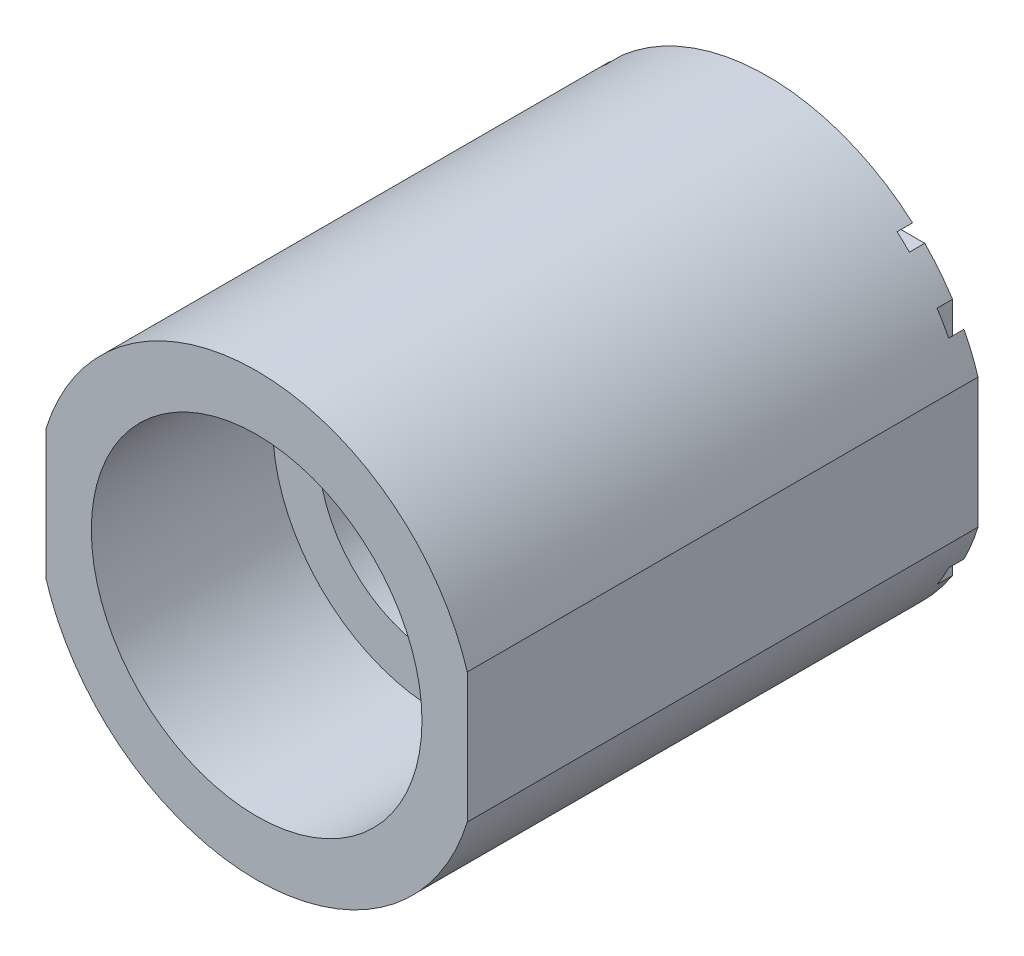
SolidWorks part; units mm, degrees
ref_plane "Front Plane" through (0, 0, 0) normal (0, 0, 1) x (1, 0, 0)
ref_plane "Top Plane" through (0, 0, 0) normal (0, 1, 0) x (1, 0, 0)
ref_plane "Right Plane" through (0, 0, 0) normal (1, 0, 0) x (0, 0, -1)
sketch "Sketch1" plane through (0, 0, 0) normal (0, 0, 1) x (1, 0, 0)
  circle A0 centre (0, 0) radius 28.575
  dimension "D1" = 57.15
extrude "Boss-Extrude1" add sketch "Sketch1" along normal blind 67
sketch "Sketch2" plane through (0, 0, 67) normal (0, 0, 1) x (1, 0, 0)
  circle A0 centre (0, 0) radius 15.4781
  dimension "D1" = 30.9562
extrude "Cut-Extrude1" cut sketch "Sketch2" against normal blind 57
sketch "Sketch3" plane through (0, 0, 67) normal (0, 0, 1) x (1, 0, 0)
  circle A0 centre (0, 0) radius 21.4312
  dimension "D1" = 42.8625
extrude "Cut-Extrude2" cut sketch "Sketch3" against normal blind 23.5
sketch "Sketch7" plane through (0, 0, 0) normal (0, 0, -1) x (-1, 0, 0)
  circle A0 centre (0, 0) radius 7.5
  dimension "D1" = 15
extrude "Cut-Extrude4" cut sketch "Sketch7" against normal up to next
sketch "Sketch4" plane through (0, 0, 0) normal (0, 1, 0) x (1, 0, 0)
  line L0 (0, -64) -> (0, -31.0654) construction
  line L1 (-16, -9.4837) -> (0, -9.4837) construction
  line L2 (-16, -65) -> (-16, 49935) construction
  line L3 (-21.4312, -67) -> (21.4312, -67) construction
  line L4 (-21.4312, -43.5) -> (21.4312, -43.5) construction
  line L5 (-8.6614, -24) -> (-8.6614, 0) construction
  line L12 (28.575, 0) -> (-28.575, 0) construction
  line L13 (-7.2, -7.7298) -> (-8.2055, -6.8)
  line L14 (-8.2055, -6.8) -> (-15.3949, -6.8)
  line L16 (7.5, 0) -> (-7.5, 0) construction
  line L17 (-7.2, 0) -> (-7.2, -7.7298)
  line L18 (-15.3949, -6.8) -> (-15.3949, 0)
  line L19 (-15.3949, 0) -> (-7.2, 0)
  point P15 (-16, -43.5)
  point P18 (-16, -67)
  point P23 (-8, -6.99)
  point P24 (-15.3, -46.0823)
  dimension "D2" = 36.51
  dimension "D3" = 6.8
  dimension "D4" = 8
  dimension "D1" = 16
  dimension "D8" = 8.6614
  dimension "D9" = 47.239
  dimension "D11" = 15.3949
  dimension "D12" = 7.2
revolve "Cut-Revolve1" cut sketch "Sketch4" angle 360 about L0
sketch "Sketch5" plane through (0, 0, 0) normal (0, 1, 0) x (1, 0, 0)
  line L0 (0, -67) -> (0, 0) construction
  line L1 (-21.4312, -67) -> (21.4312, -67) construction
  line L2 (-16, -64) -> (-16, -33.0173) construction
  line L3 (16, -64) -> (16, -33.9491) construction
  line L5 (-21.4312, -43.5) -> (21.4312, -43.5) construction
  arc A0 (-16, -42.5) -> (16, -42.5) centre (0, 81.4677) ccw construction
  point P12 (0, -43.5283)
  dimension "D3" = 124.996
  dimension "D1" = 16
  dimension "D2" = 16
  dimension "D4" = 1
ref_plane "Plane1" through (0, 0, 43.5283) normal (0, 0, 1) x (1, 0, 0)
sketch "Sketch9" plane through (0, 0, 0) normal (0, 1, 0) x (1, 0, 0)
  line L0 (-15.3, -43.5) -> (-7.2, -7.4524) construction
  line L1 (-21.4312, -43.5) -> (21.4312, -43.5) construction
  line L2 (-7.5, -7.4524) -> (7.5, -7.4524) construction
  line L3 (-7.2, -7.4524) -> (-7.8826, -10)
  line L5 (-15.4781, -10) -> (15.4781, -10) construction
  line L6 (-7.8826, -10) -> (-6.9946, -10)
  line L7 (-6.9946, -10) -> (-6.9946, -7.4524)
  line L10 (-6.9946, -7.4524) -> (-7.2, -7.4524)
  line L11 (0, -67) -> (0, 0) construction
  dimension "D1" = 15
  dimension "D2" = 7.2
revolve "Cut-Revolve2" [suppressed] cut sketch "Sketch9" angle 360 about L0
sketch "Sketch10" plane through (0, 0, 67) normal (0, 0, 1) x (1, 0, 0)
  line L0 (-27.305, 8.4242) -> (-27.305, -8.4242)
  line L1 (0, 0) -> (0, 50000) construction
  line L2 (27.305, 8.4242) -> (27.305, -8.4242)
  circle A0 centre (0, 0) radius 27.305 construction
  circle A1 centre (0, 0) radius 28.575 construction
  arc A2 (-27.305, 8.4242) -> (-27.305, -8.4242) centre (0, 0) ccw
  arc A3 (27.305, 8.4242) -> (27.305, -8.4242) centre (0, 0) cw
  dimension "D1" = 54.61
extrude "Cut-Extrude5" cut sketch "Sketch10" against normal through all
ref_plane "Plane2" through (0, 28.575, 0) normal (0, 1, 0) x (1, 0, 0)
hole_wizard "1/4-20 Tapped Hole1" positions "Sketch15" profile "Sketch14" tap size "1/4-20" standard "ANSI Inch"
sketch "Sketch15" plane through (27.305, 3.5472, -3.5809) normal (-1, 0, 0) x (0, 0, 1)
  line L0 (3.5809, -11.9714) -> (3.5809, 4.877) construction
  point P0 (38.5809, -3.5472)
  dimension "D1" = 35
sketch "Sketch14" plane through (27.305, 0, 35) normal (0, 1, 0) x (0, 0, -1)
  line L0 (0, 0) -> (0, 9.1538)
  line L1 (0, 9.1538) -> (2.5527, 7.62)
  line L2 (2.5527, 7.62) -> (2.5527, 0)
  line L5 (2.5527, 0) -> (0, 0)
  line L10 (0, 9.1538) -> (-2.5527, 7.62) construction
  line L11 (0, -6.35) -> (0, 107.95) construction
  dimension "Tap Drill Dia." = 5.1054
  dimension "Tap Drill Depth" = 7.62
  dimension "Drill Angle" = 118
sketch "Sketch16" plane through (0, 0, 0) normal (0, 0, -1) x (-1, 0, 0)
  circle A0 centre (0, 0) radius 38.1
  dimension "D1" = 76.2
extrude "Cut-Extrude7" cut sketch "Sketch16" against normal blind 0.8
sketch "Sketch17" plane through (0, 0, 0.8) normal (0, 0, -1) x (-1, 0, 0)
  line L0 (0, 0) -> (0, 50000) construction
  line L1 (0, 28.575) -> (-27.305, 28.575) construction
  line L2 (-25.5, 28.575) -> (-24, 28.575)
  line L3 (-25.5, 28.575) -> (-25.5, -28.575)
  line L4 (-25.5, -28.575) -> (-24, -28.575)
  line L5 (-24, 28.575) -> (-24, -28.575)
  line L6 (0, -28.575) -> (-27.305, -28.575) construction
  line L9 (24, 28.575) -> (24, -28.575)
  line L10 (25.5, -28.575) -> (24, -28.575)
  line L11 (25.5, 28.575) -> (25.5, -28.575)
  line L12 (25.5, 28.575) -> (24, 28.575)
  arc A0 (27.305, 8.4242) -> (-27.305, 8.4242) centre (0, 0) ccw construction
  arc A1 (-27.305, -8.4242) -> (27.305, -8.4242) centre (0, 0) ccw construction
  dimension "D1" = 1.5
  dimension "D2" = 24
extrude "Cut-Extrude8" cut sketch "Sketch17" against normal blind 2
sketch "Sketch18" plane through (0, 0, 0.8) normal (0, 0, -1) x (-1, 0, 0)
  line L0 (25.5, -12.895) -> (25.5, 12.895) construction
  line L1 (-25.5, 21.5) -> (25.5, 21.5)
  line L2 (-25.5, 21.5) -> (-25.5, 20)
  line L3 (-25.5, 20) -> (25.5, 20)
  line L4 (25.5, 21.5) -> (25.5, 20)
  line L5 (-25.5, 12.895) -> (-25.5, -12.895) construction
  dimension "D1" = 1.5
  dimension "D2" = 20
extrude "Cut-Extrude9" cut sketch "Sketch18" against normal blind 2
hole_wizard "#1-64 Tapped Hole1" positions "Sketch20" profile "Sketch19" tap size "#1-64" standard "ANSI Inch"
sketch "Sketch20" plane through (0, 0, 0.8) normal (0, 0, -1) x (-1, 0, 0)
  point P0 (0, 22.475)
sketch "Sketch19" plane through (0, 22.475, 0.8) normal (1, 0, 0) x (0, 1, 0)
  line L0 (0, 0) -> (0, 5.354)
  line L1 (0, 5.354) -> (0.7556, 4.9)
  line L2 (0.7556, 4.9) -> (0.7556, 0)
  line L5 (0.7556, 0) -> (0, 0)
  line L10 (0, 5.354) -> (-0.7557, 4.9) construction
  line L11 (0, -6.35) -> (0, 107.95) construction
  dimension "Tap Drill Dia." = 1.5113
  dimension "Tap Drill Depth" = 4.9
  dimension "Drill Angle" = 118
